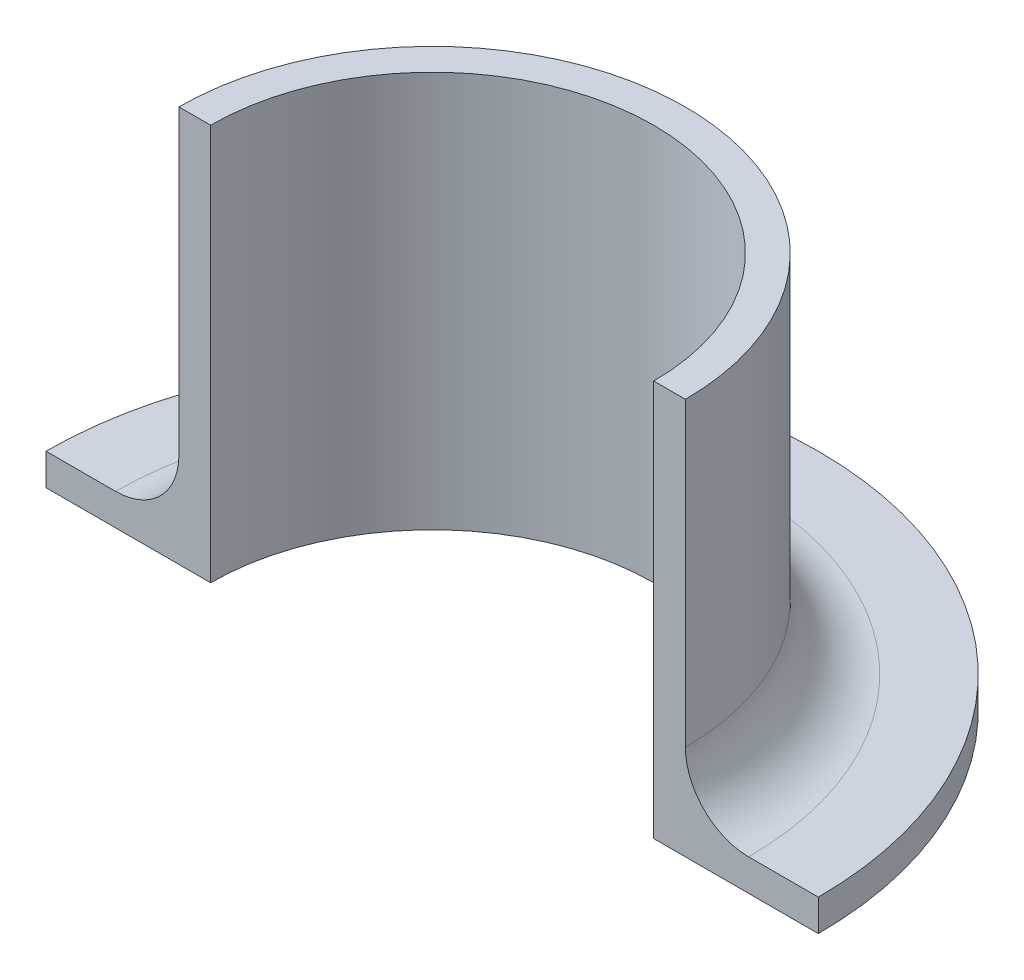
SolidWorks part; units mm, degrees
ref_plane "Front Plane" through (0, 0, 0) normal (0, 0, 1) x (1, 0, 0)
ref_plane "Top Plane" through (0, 0, 0) normal (0, 1, 0) x (1, 0, 0)
ref_plane "Right Plane" through (0, 0, 0) normal (1, 0, 0) x (0, 0, -1)
sketch "Sketch1" plane through (0, 0, 0) normal (0, 0, 1) x (1, 0, 0)
  line L0 (-22.225, 17.1894) -> (-22.225, -22.5616)
  line L1 (-22.225, -22.5616) -> (-38.735, -22.5616)
  line L2 (-38.735, -22.5616) -> (-38.735, -19.3866)
  line L3 (-38.735, -19.3866) -> (-31.75, -19.3866)
  line L4 (-25.4, -13.0366) -> (-25.4, 17.1894)
  line L8 (0, 41.9158) -> (0, -33.8684) construction
  line L9 (-22.225, 17.1894) -> (-25.4, 17.1894)
  arc A0 (-31.75, -19.3866) -> (-25.4, -13.0366) centre (-31.75, -13.0366) ccw
  dimension "D4" = 6.35
  dimension "D1" = 25.4
  dimension "D2" = 3.175
  dimension "D3" = 16.51
  dimension "D6" = 3.175
  dimension "D7" = 39.751
revolve "Revolve1" add sketch "Sketch1" angle 180 about L8
